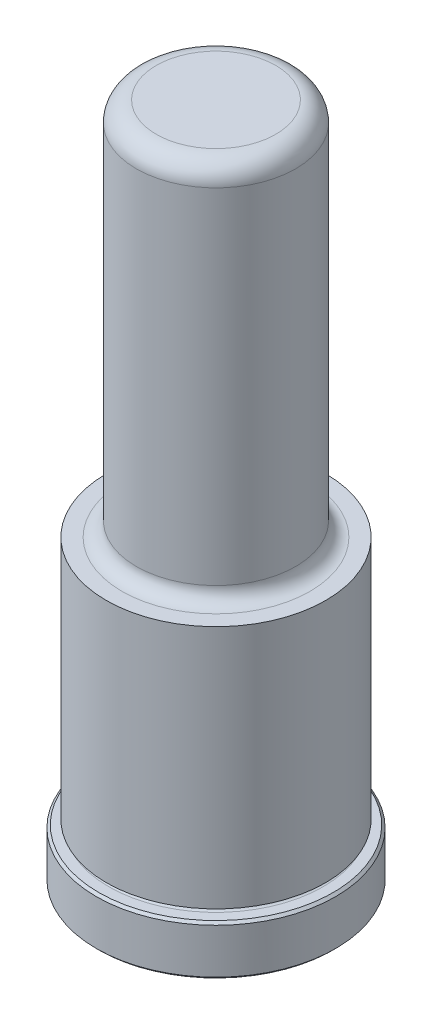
SolidWorks part; units mm, degrees
ref_plane "Front Plane" through (0, 0, 0) normal (0, 0, 1) x (1, 0, 0)
ref_plane "Top Plane" through (0, 0, 0) normal (0, 1, 0) x (1, 0, 0)
ref_plane "Right Plane" through (0, 0, 0) normal (1, 0, 0) x (0, 0, -1)
sketch "Sketch1" plane through (0, 0, 0) normal (1, 0, 0) x (0, 0, -1)
  line L0 (0, 0) -> (19.05, 0)
  line L1 (19.05, 0) -> (19.05, 7.9248)
  line L2 (19.05, 7.9248) -> (17.0688, 7.9248)
  line L3 (16.6878, 2.6782) -> (16.6878, 5.9795) construction
  line L4 (17.0688, 8.6868) -> (17.4752, 8.6868)
  line L5 (17.4752, 8.6868) -> (17.4752, 47.625)
  line L6 (17.4752, 47.625) -> (14.9733, 47.625)
  line L7 (12.6873, 49.911) -> (12.6873, 107.95)
  line L9 (12.6873, 107.95) -> (0, 107.95)
  line L10 (0, 107.95) -> (0, 0)
  line L11 (0, 0) -> (0, -7.2694) construction
  arc A0 (17.0688, 8.6868) -> (17.0688, 7.9248) centre (17.0688, 8.3058) ccw
  arc A1 (14.9733, 47.625) -> (12.6873, 49.911) centre (14.9733, 49.911) cw
  point P2 (12.6873, 107.95)
  point P14 (12.6873, 108.1902)
  point P19 (12.6873, 47.625)
  dimension "D14" = 0.762
  dimension "D8" = 2.286
  dimension "T" = 7.9248
  dimension "D2" = 0.762
  dimension "M" = 38.1
  dimension "B" = 34.9504
  dimension "L" = 107.95
  dimension "D7" = 0.7874
  dimension "A" = 47.625
  dimension "D" = 25.3746
  dimension "D15" = 60.325
revolve "Revolve1" add sketch "Sketch1" angle 360 about L11
chamfer "Chamfer1" distance 0.381 angle 45 2 edges at (0, 0, 19.05) (0, 7.9248, 19.05)
fillet "Fillet7" radius 3.175 1 edges at (0, 107.95, 12.6873)
